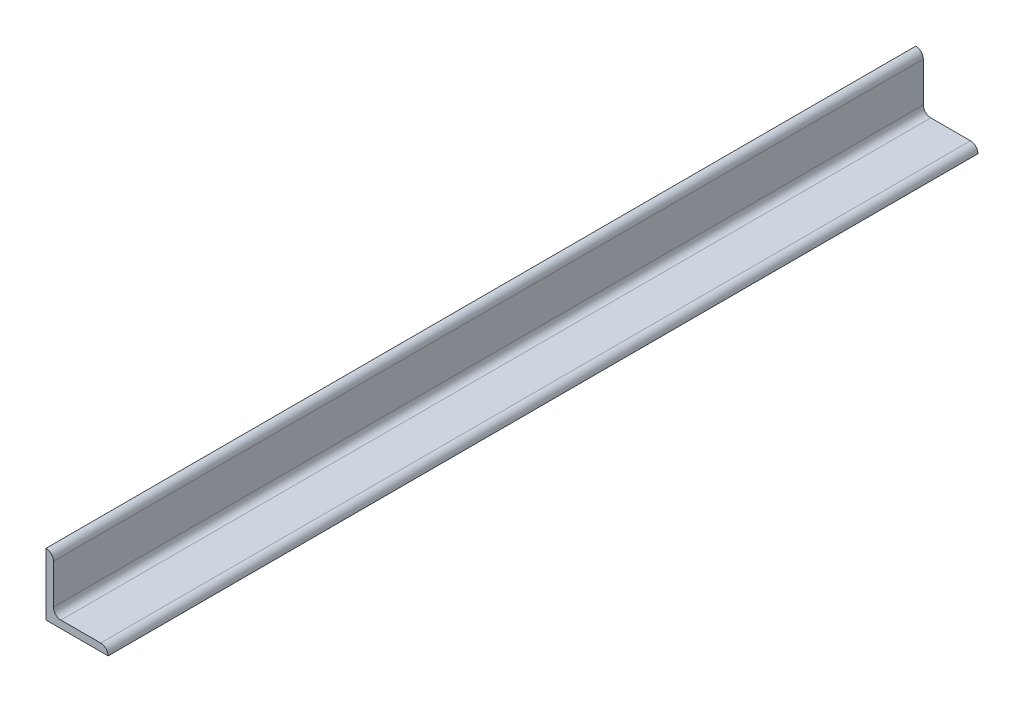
SolidWorks part; units mm, degrees
ref_plane "Front" through (0, 0, 0) normal (0, 0, 1) x (1, 0, 0)
ref_plane "Top" through (0, 0, 0) normal (0, 1, 0) x (1, 0, 0)
ref_plane "Right" through (0, 0, 0) normal (1, 0, 0) x (0, 0, -1)
sketch "Sketch1" plane through (0, 0, 0) normal (0, 0, 1) x (1, 0, 0)
  line L0 (0, 50) -> (0, 0)
  line L2 (6, 50) -> (6, 12)
  line L3 (12, 6) -> (50, 6)
  line L5 (50, 0) -> (0, 0)
  line L6 (50, 6) -> (50, 0)
  line L7 (0, 50) -> (6, 50)
  arc A0 (12, 6) -> (6, 12) centre (12, 12) cw
  dimension "Thickness" = 6
  dimension "Height" = 50
  dimension "Width" = 50
extrude "Extrude1" add sketch "Sketch1" against normal mid plane 700
fillet "Fillet1" radius 6 2 edges at (50, 6, 0) (6, 50, 0)
equation "\"D1@Fillet1\" = \"Thickness@Sketch1\""
